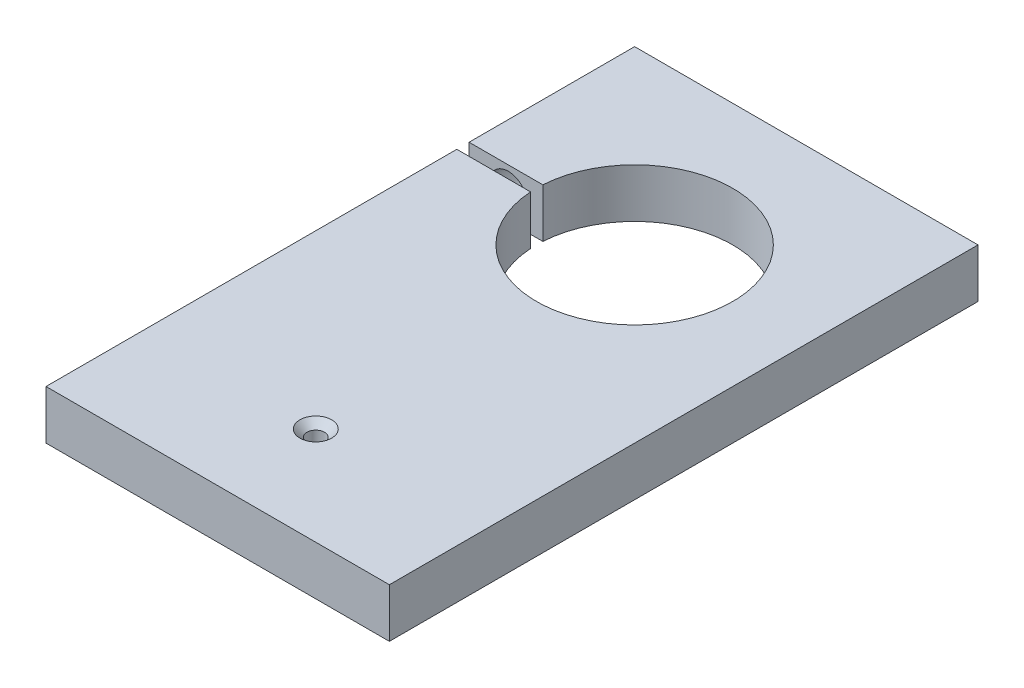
SolidWorks part; units mm, degrees
ref_plane "Front" through (0, 0, 0) normal (0, 0, 1) x (1, 0, 0)
ref_plane "Top" through (0, 0, 0) normal (0, 1, 0) x (1, 0, 0)
ref_plane "Right" through (0, 0, 0) normal (1, 0, 0) x (0, 0, -1)
sketch "Sketch1" plane through (0, 0, 0) normal (0, 1, 0) x (1, 0, 0)
  line L1 (-22.225, 38.1) -> (22.225, 38.1)
  line L2 (-22.225, 38.1) -> (-22.225, -38.1)
  line L3 (-22.225, -38.1) -> (22.225, -38.1)
  line L4 (22.225, 38.1) -> (22.225, -38.1)
  line L5 (-22.225, 38.1) -> (22.225, -38.1) construction
  line L6 (-22.225, -38.1) -> (22.225, 38.1) construction
  line L7 (0, 15.875) -> (-22.225, 15.875) construction
  line L8 (0, 16.6688) -> (-22.225, 16.6688)
  line L10 (0, 15.0813) -> (-22.225, 15.0813)
  circle A0 centre (0, 15.875) radius 22.225 construction
  circle A1 centre (0, -15.875) radius 22.225 construction
  circle A2 centre (0, 15.875) radius 12.7
  point P0 (0, 0)
  dimension "D1" = 9.525
  dimension "D3" = 25.4
  dimension "D2" = 76.2
  dimension "D5" = 0.7937
  dimension "D6" = 0.7937
extrude "Extrude1" add sketch "Sketch1" along normal blind 6.35
hole_wizard "#8 Clearance Hole1" positions "3DSketch1" profile "Sketch2" hole size "#8" standard "Ansi Inch"
sketch3d "3DSketch1"
  line L0 (-17.145, 0, 38.1) -> (-17.145, 6.35, 38.1) construction
  line L1 (-22.225, 0, 38.1) -> (22.225, 0, 38.1) construction
  line L2 (-22.225, 6.35, 38.1) -> (22.225, 6.35, 38.1) construction
  line L4 (-17.145, 6.35, 38.1) -> (-17.145, 0, 38.1) construction
  line L5 (-17.145, 6.35, -38.1) -> (-17.145, 0, -38.1) construction
  line L6 (-22.225, 6.35, -38.1) -> (22.225, 6.35, -38.1) construction
  line L7 (-22.225, 0, -38.1) -> (22.225, 0, -38.1) construction
  line L9 (-22.225, 6.35, -38.1) -> (-22.225, 0, -38.1) construction
  line L10 (-22.225, 6.35, 38.1) -> (-22.225, 0, 38.1) construction
  point P2 (-17.145, 3.175, -38.1)
  dimension "D1" = 5.08
  dimension "D2" = 5.08
sketch "Sketch2" plane through (-17.145, 3.175, -38.1) normal (1, 0, 0) x (0, 1, 0)
  line L0 (0, 0) -> (0, 23.0666)
  line L1 (0, 23.0666) -> (2.4574, 21.59)
  line L2 (2.4574, 21.59) -> (2.4574, 0)
  line L5 (2.4574, 0) -> (0, 0)
  line L10 (0, 23.0666) -> (-2.4575, 21.59) construction
  line L11 (0, -6.35) -> (0, 107.95) construction
  dimension "Hole Dia." = 4.9149
  dimension "Hole Depth" = 21.59
  dimension "Drill Angle" = 118
hole_wizard "#8-32 Tapped Hole1" positions "3DSketch3" profile "Sketch5" tap size "#8-32" standard "Ansi Inch"
sketch3d "3DSketch3"
  line L3 (-17.145, 3.175, -16.6688) -> (-17.145, 3.175, -38.1) construction
  point P0 (-17.145, 3.175, -38.1)
sketch "Sketch5" plane through (-17.145, 3.175, -38.1) normal (1, 0, 0) x (0, 1, 0)
  line L0 (0, 0) -> (0, 35.4802)
  line L1 (0, 35.4802) -> (1.7272, 34.4424)
  line L2 (1.7272, 34.4424) -> (1.7272, 0.635)
  line L3 (1.7272, 0.635) -> (2.3622, 0)
  line L5 (2.3622, 0) -> (0, 0)
  line L6 (-1.7272, 0.635) -> (-2.3622, 0) construction
  line L10 (0, 35.4802) -> (-1.7272, 34.4424) construction
  line L11 (0, -6.35) -> (0, 107.95) construction
  dimension "Tap Drill Dia." = 3.4544
  dimension "Tap Drill Depth" = 34.4424
  dimension "Near C'Sink Dia." = 4.7244
  dimension "Near C'Sink Angle" = 90
  dimension "Drill Angle" = 118
hole_wizard "#4-40 Tapped Hole1" positions "3DSketch4" profile "Sketch7" tap size "#4-40" standard "Ansi Inch"
sketch3d "3DSketch4"
  line L0 (0, 6.35, 38.1) -> (0, 6.35, -38.1) construction
  line L1 (-22.225, 6.35, 38.1) -> (22.225, 6.35, 38.1) construction
  line L2 (-22.225, 6.35, -38.1) -> (22.225, 6.35, -38.1) construction
  point P0 (0, 6.35, 25.4)
  dimension "D1" = 12.7
sketch "Sketch7" plane through (0, 6.35, 25.4) normal (1, 0, 0) x (0, 0, 1)
  line L0 (0, 0) -> (0, 6.35)
  line L1 (0, 6.35) -> (1.1303, 6.35)
  line L2 (1.1303, 6.35) -> (1.1303, 0.9271)
  line L3 (1.1303, 0.9271) -> (2.0574, 0)
  line L5 (2.0574, 0) -> (0, 0)
  line L6 (-1.1303, 0.9271) -> (-2.0574, 0) construction
  line L11 (0, -6.35) -> (0, 107.95) construction
  dimension "Thru Tap Drill Dia." = 2.2606
  dimension "Thru Tap Drill Depth" = 6.35
  dimension "Near C'Sink Dia." = 4.1148
  dimension "Near C'Sink Angle" = 90
